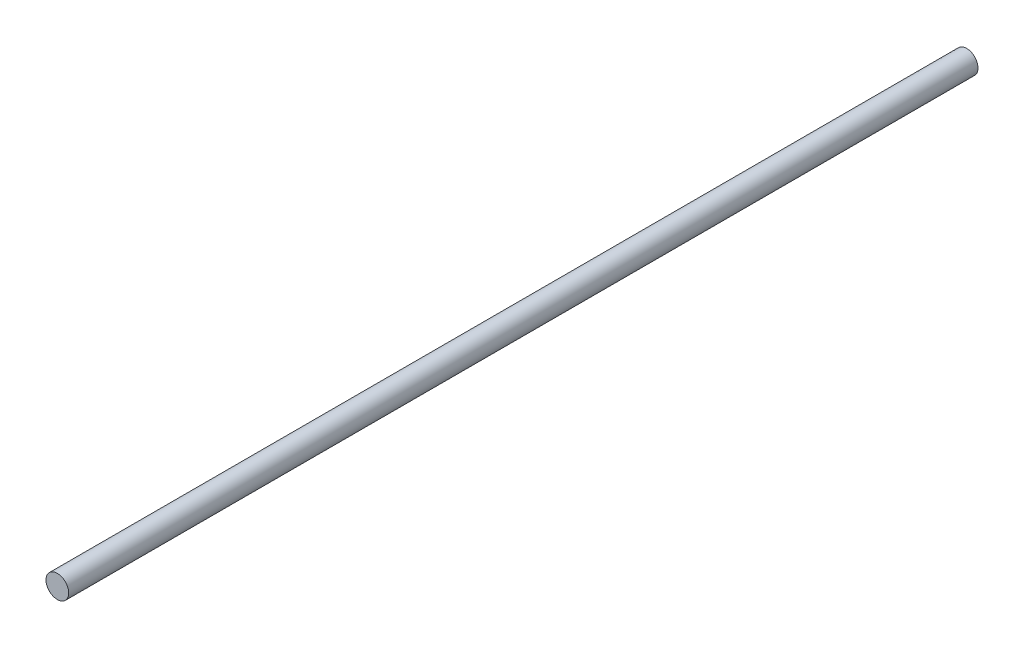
SolidWorks part; units mm, degrees
ref_plane "Front Plane" through (0, 0, 0) normal (0, 0, 1) x (1, 0, 0)
ref_plane "Top Plane" through (0, 0, 0) normal (0, 1, 0) x (1, 0, 0)
ref_plane "Right Plane" through (0, 0, 0) normal (1, 0, 0) x (0, 0, -1)
sketch "Sketch1" plane through (0, 0, 0) normal (0, 0, 1) x (1, 0, 0)
  circle A0 centre (0, 0) radius 12.5
  dimension "D1" = 25
extrude "Boss-Extrude1" add sketch "Sketch1" along normal blind 1000
